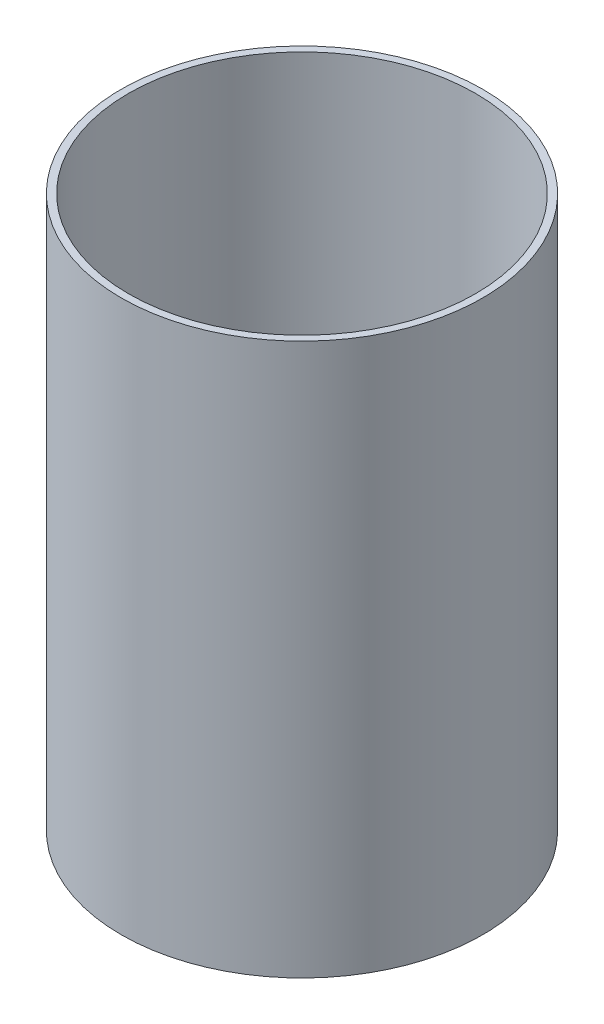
SolidWorks part; units mm, degrees
ref_plane "Plane1" through (0, 0, 0) normal (0, 0, 1) x (1, 0, 0)
ref_plane "Plane2" through (0, 0, 0) normal (0, 1, 0) x (1, 0, 0)
ref_plane "Plane3" through (0, 0, 0) normal (1, 0, 0) x (0, 0, -1)
sketch "Sketch1" plane through (0, 0, 0) normal (0, 0, 1) x (1, 0, 0)
  line L0 (0, 88.5301) -> (0, -78.0331) construction
  line L1 (-76.0387, 0) -> (74.5428, 0) construction
  line L2 (39.624, 62.9666) -> (41.275, 62.9666)
  line L3 (41.275, 62.9666) -> (41.275, -62.9666)
  line L4 (41.275, -62.9666) -> (39.624, -62.9666)
  line L5 (39.624, -62.9666) -> (39.624, 62.9666)
  dimension "D1" = 82.55
  dimension "D2" = 1.651
  dimension "D3" = 125.9332
revolve "Base-Revolve" add sketch "Sketch1" angle 360 about L0
